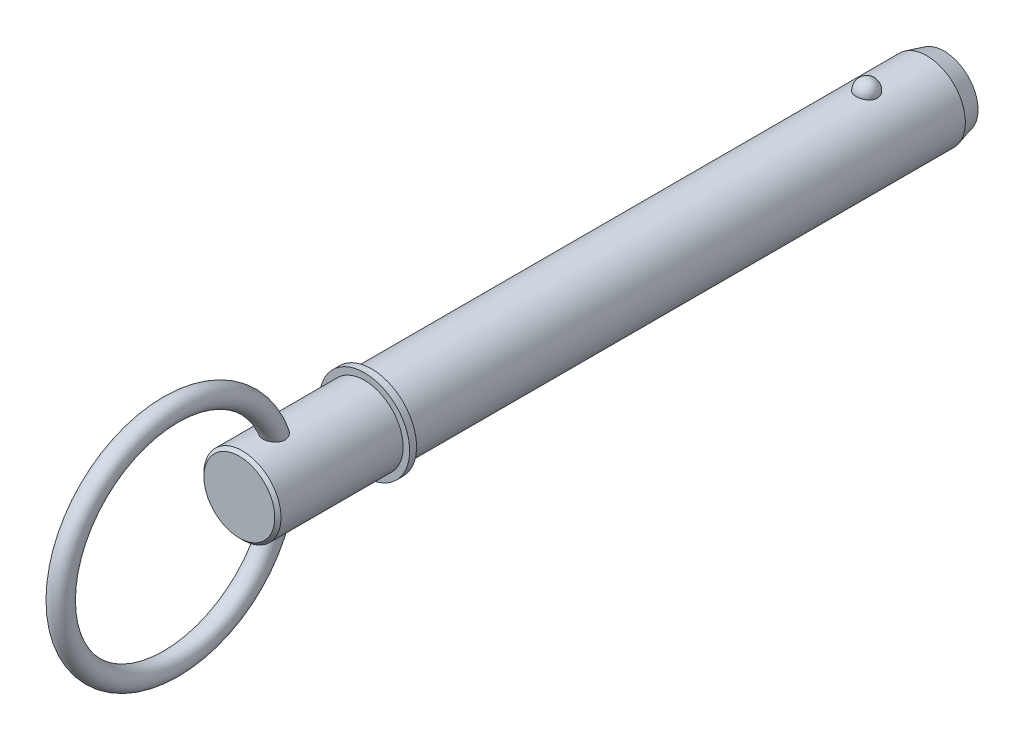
SolidWorks part; units mm, degrees
ref_plane "Front Plane" through (0, 0, 0) normal (0, 0, 1) x (1, 0, 0)
ref_plane "Top Plane" through (0, 0, 0) normal (0, 1, 0) x (1, 0, 0)
ref_plane "Right Plane" through (0, 0, 0) normal (1, 0, 0) x (0, 0, -1)
sketch "Sketch2" plane through (0, 0, 0) normal (0, 0, 1) x (1, 0, 0)
  circle A0 centre (0, 0) radius 11.115
  point P3 (0, 11.115)
  dimension "D1" = 22.23
extrude "Boss-Extrude1" add sketch "Sketch2" along normal blind 139.7
sketch "Sketch3" plane through (0, 0, 0) normal (0, 0, -1) x (-1, 0, 0)
  circle A0 centre (0, 0) radius 11.115
  dimension "D1" = 22.23
extrude "Boss-Extrude2" add sketch "Sketch3" along normal blind 25.4
chamfer "Chamfer1" distance 5 angle 15 1 edges at (-11.115, 0, -25.4)
sketch "Sketch18" plane through (0, 0, 0) normal (1, 0, 0) x (0, 0, -1)
  line L0 (20.4, 11.115) -> (-139.7, 11.115) construction
  line L1 (3.07, 14.185) -> (3.07, 8.045)
  line L2 (-139.7, -11.115) -> (20.4, -11.115) construction
  arc A0 (3.07, 14.185) -> (3.07, 8.045) centre (3.07, 11.115) ccw
  point P4 (0, 11.115)
  dimension "D1" = 25.3
revolve "Revolve1" add sketch "Sketch18" angle 360 about L1
sketch "Sketch19" plane through (0, 0, 0) normal (1, 0, 0) x (0, 0, -1)
  line L0 (-33.7288, 0) -> (-46.4542, 0) construction
sketch "Sketch20" plane through (0, 0, 0) normal (1, 0, 0) x (0, 0, -1)
  line L0 (-139.7, 0) -> (-139.7, 13)
  line L1 (-139.7, 11.115) -> (-139.7, -11.115) construction
  line L2 (-139.7, 13) -> (-141.7, 13)
  line L3 (-141.7, 13) -> (-141.7, 0)
  line L4 (-33.7288, 0) -> (-46.4542, 0) construction
  line L5 (-141.7, 0) -> (-139.7, 0)
  dimension "D1" = 13
  dimension "D2" = 2
revolve "Revolve2" add sketch "Sketch20" angle 360 about L0
sketch "Sketch21" plane through (0, 0, 139.7) normal (0, 0, -1) x (-1, 0, 0)
  circle A0 centre (0, 0) radius 11.115
  dimension "D1" = 22.23
extrude "Boss-Extrude3" add sketch "Sketch21" against normal blind 38.1
chamfer "Chamfer2" distance 0.9 angle 45 1 edges at (-11.115, 0, 177.8)
sketch "Sketch23" plane through (0, 0, 0) normal (1, 0, 0) x (0, 0, -1)
  line L0 (-177.8, 10.215) -> (-177.8, -10.215) construction
  circle A0 centre (-197.55, 0) radius 31.75
  point P2 (-165.8, 0)
  dimension "D1" = 63.5
  dimension "D2" = 12
sketch "Sketch24" plane through (0, 0, 0) normal (0, 1, 0) x (1, 0, 0)
  circle A0 centre (0, -165.8) radius 3
  dimension "D1" = 6
sweep "Sweep1" add profiles "Sketch24" path "Sketch23"
